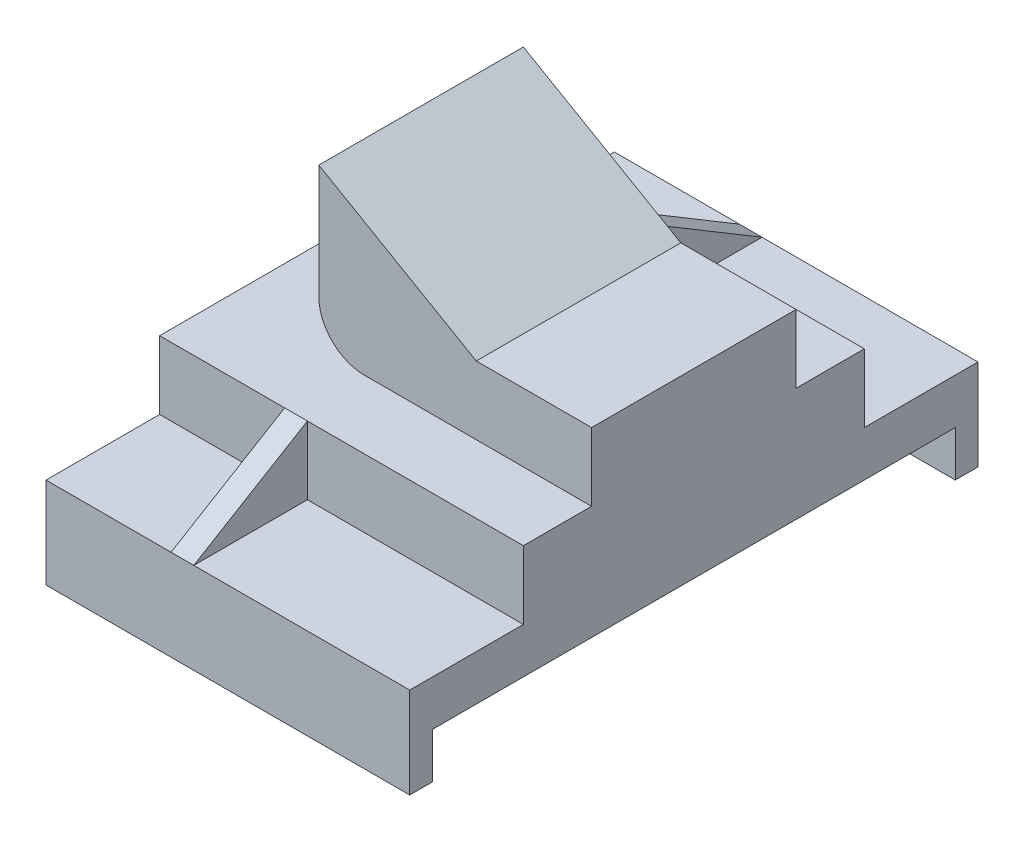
SolidWorks part; units mm, degrees
ref_plane "Front Plane" through (0, 0, 0) normal (0, 0, 1) x (1, 0, 0)
ref_plane "Top Plane" through (0, 0, 0) normal (0, 1, 0) x (1, 0, 0)
ref_plane "Right Plane" through (0, 0, 0) normal (1, 0, 0) x (0, 0, -1)
sketch "Sketch1" plane through (0, 0, 0) normal (1, 0, 0) x (0, 0, -1)
  line L0 (0, 0) -> (0, 20)
  line L1 (0, 20) -> (25, 20)
  line L2 (25, 20) -> (25, 35)
  line L3 (25, 35) -> (100, 35)
  line L4 (100, 35) -> (100, 20)
  line L5 (100, 20) -> (125, 20)
  line L6 (125, 20) -> (125, 0)
  line L7 (125, 0) -> (120, 0)
  line L8 (120, 0) -> (120, 10)
  line L9 (120, 10) -> (5, 10)
  line L10 (5, 10) -> (5, 0)
  line L11 (5, 0) -> (0, 0)
  dimension "D1" = 15
  dimension "D2" = 5
  dimension "D3" = 25
  dimension "D4" = 35
  dimension "D5" = 10
  dimension "D6" = 125
extrude "Extrude1" add sketch "Sketch1" along normal mid plane 80
ref_plane "Plane1" through (0, 0, -62.5) normal (0, 0, 1) x (1, 0, 0)
sketch "Sketch2" plane through (0, 0, -62.5) normal (0, 0, 1) x (1, 0, 0)
  line L0 (-20, 45) -> (-20, 70)
  line L1 (40, 35) -> (-40, 35) construction
  line L2 (-20, 70) -> (14.641, 50)
  line L4 (14.641, 50) -> (40, 50)
  line L5 (40, 50) -> (40, 35)
  line L6 (40, 35) -> (-10, 35)
  arc A0 (-20, 45) -> (-10, 35) centre (-10, 45) ccw
  point P11 (-20, 35)
  dimension "D2" = 60
  dimension "D3" = 35
  dimension "D5" = 10
  dimension "D1" = 15
  dimension "D4" = 60
extrude "Extrude2" add sketch "Sketch2" along normal offset from surface 15 and the other way offset from surface (22.5 mm away) 15
ref_plane "Plane2" through (-10, 0, 0) normal (1, 0, 0) x (0, 0, -1)
sketch "Sketch4" plane through (-10, 0, 0) normal (1, 0, 0) x (0, 0, -1)
  line L4 (0, 20) -> (25, 35)
  line L5 (100, 35) -> (125, 20)
  line L6 (125, 20) -> (100, 20)
  line L7 (100, 20) -> (100, 35)
  line L12 (25, 35) -> (25, 20)
  line L13 (25, 20) -> (0, 20)
  line L14 (5, 0) -> (120, 0)
  line L15 (120, 0) -> (120, 10)
  line L16 (120, 10) -> (5, 10)
  line L17 (5, 10) -> (5, 0)
extrude "Extrude3" add sketch "Sketch4" along normal mid plane 5
